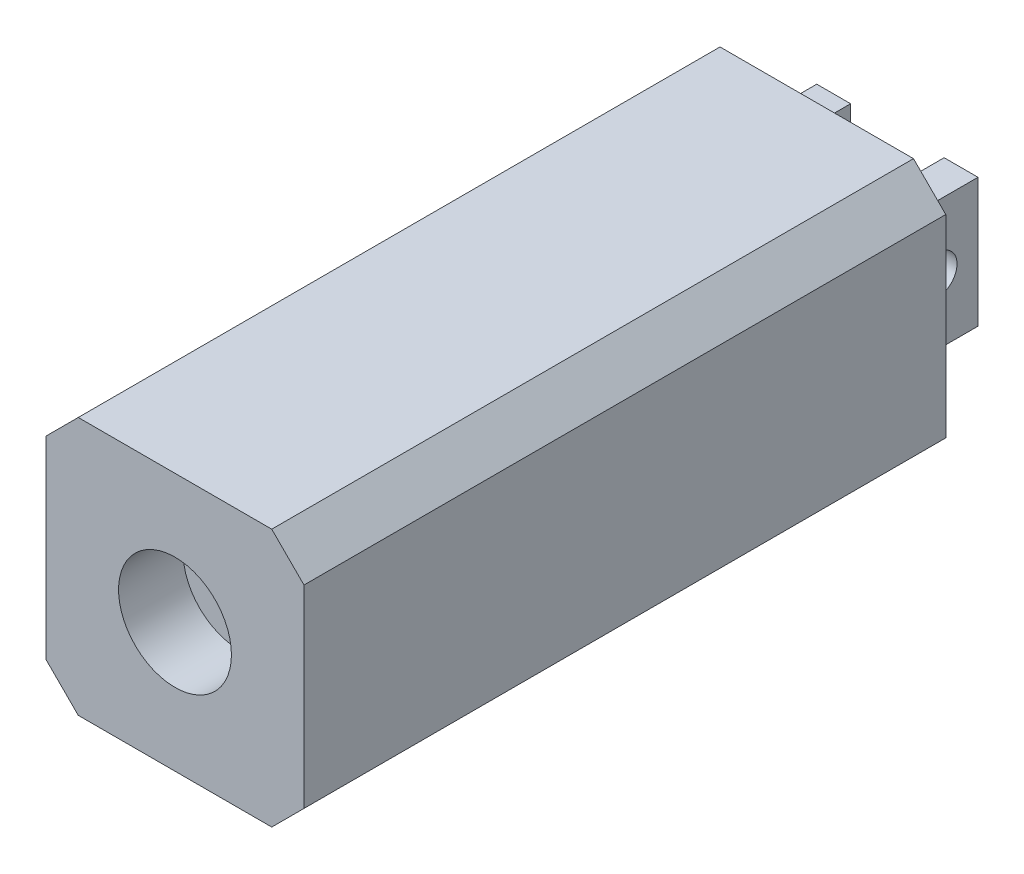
SolidWorks part; units mm, degrees
ref_plane "Plan1" through (0, 0, 0) normal (0, 0, 1) x (1, 0, 0)
ref_plane "Plan2" through (0, 0, 0) normal (0, 1, 0) x (1, 0, 0)
ref_plane "Plan3" through (0, 0, 0) normal (1, 0, 0) x (0, 0, -1)
sketch "Esquisse1" plane through (0, 0, 0) normal (0, 0, 1) x (1, 0, 0)
  line L1 (0, 0) -> (80, 0)
  line L2 (0, 0) -> (0, 80)
  line L3 (0, 80) -> (80, 80)
  line L4 (80, 0) -> (80, 80)
  dimension "D1" = 80
  dimension "D2" = 80
extrude "Base-Extrusion" add sketch "Esquisse1" along normal blind 199
chamfer "Chanfrein1" distance 10 angle 45
sketch "Esquisse2" plane through (0, 0, 199) normal (0, 0, 1) x (1, 0, 0)
  line L0 (70, 80) -> (10, 80) construction
  line L1 (0, 70) -> (0, 10) construction
  circle A0 centre (40, 40) radius 17.5
  dimension "D1" = 35
  dimension "D2" = 40
  dimension "D3" = 40
extrude "Enlèv. mat.-Extru.1" cut sketch "Esquisse2" against normal blind 20
sketch "Esquisse3" plane through (0, 0, 0) normal (0, 0, -1) x (-1, 0, 0)
  line L0 (0, 70) -> (0, 10) construction
  line L1 (-65, 20) -> (-15, 20)
  line L2 (-65, 20) -> (-65, 60)
  line L3 (-65, 60) -> (-15, 60)
  line L4 (-15, 20) -> (-15, 60)
  line L5 (-80, 10) -> (-80, 70) construction
  dimension "D1" = 15
  dimension "D2" = 15
extrude "Boss.-Extru.1" add sketch "Esquisse3" along normal blind 25
sketch "Esquisse4" plane through (0, 0, -25) normal (0, 0, -1) x (-1, 0, 0)
  line L0 (-15, 60) -> (-65, 60) construction
  line L1 (-54.5, 20) -> (-25.5, 20)
  line L2 (-54.5, 20) -> (-54.5, 60)
  line L3 (-54.5, 60) -> (-25.5, 60)
  line L4 (-25.5, 20) -> (-25.5, 60)
  line L5 (-65, 20) -> (-15, 20) construction
  line L6 (0, 70) -> (0, 10) construction
  dimension "D1" = 29
  dimension "D2" = 25.5
extrude "Enlèv. mat.-Extru.2" cut sketch "Esquisse4" against normal blind 25
sketch "Esquisse5" plane through (15, 0, 0) normal (-1, 0, 0) x (0, 0, 1)
  line L0 (179, 40) -> (199, 40) construction
  line L1 (0, 70) -> (0, 10) construction
  line L2 (-25, 20) -> (-25, 60) construction
  circle A0 centre (-12.5, 40) radius 6
  dimension "D1" = 12
  dimension "D2" = 12.5
extrude "Enlèv. mat.-Extru.3" cut sketch "Esquisse5" against normal through all
